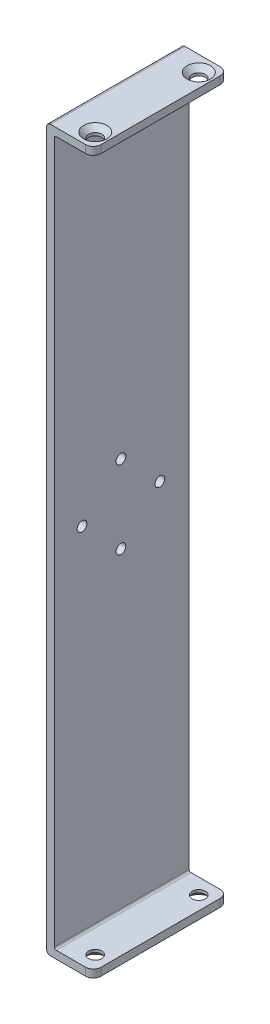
SolidWorks part; units mm, degrees
ref_plane "Front" through (0, 0, 0) normal (0, 0, 1) x (1, 0, 0)
ref_plane "Top" through (0, 0, 0) normal (0, 1, 0) x (1, 0, 0)
ref_plane "Right" through (0, 0, 0) normal (1, 0, 0) x (0, 0, -1)
sketch "Sketch1" plane through (0, 0, 0) normal (0, 0, 1) x (1, 0, 0)
  line L0 (12, 183) -> (12, 185)
  line L1 (0, 0) -> (12, 0)
  line L2 (0, 0) -> (0, 185)
  line L3 (0, 185) -> (12, 185)
  line L4 (12, 0) -> (12, 2)
  line L5 (12, 183) -> (2, 183)
  line L7 (12, 2) -> (2, 2)
  line L8 (2, 183) -> (2, 2)
  dimension "D1" = 2
  dimension "D2" = 2
  dimension "D3" = 2
  dimension "D4" = 181
  dimension "D5" = 10
extrude "Boss-Extrude1" add sketch "Sketch1" along normal blind 34.6
hole_wizard "CSK for M3 Cross recessed CTSK head wood screws1" positions "Sketch2" profile "Sketch4" countersink size "M3" standard "GB"
sketch "Sketch2" plane through (0, 185, 0) normal (0, 1, 0) x (1, 0, 0)
  line L1 (12, -34.6) -> (12, 0) construction
  line L11 (8.5, -4) -> (8.5, 0) construction
  line L12 (12, 0) -> (0, 0) construction
  line L14 (8.5, -30.6) -> (8.5, -34.6) construction
  line L15 (12, -34.6) -> (0, -34.6) construction
  point P0 (8.5, -4)
  point P2 (8.5, -30.6)
  dimension "D1" = 26.6
  dimension "D2" = 3.5
  dimension "D3" = 3.5
sketch "Sketch4" plane through (8.5, 185, 4) normal (1, 0, 0) x (0, 0, 1)
  line L0 (0, 0) -> (0, 5.5215)
  line L1 (0, 5.5215) -> (1.7, 4.5)
  line L2 (1.7, 4.5) -> (1.7, 1.3)
  line L3 (1.7, 1.3) -> (3, 0)
  line L5 (3, 0) -> (0, 0)
  line L6 (-1.7, 1.3) -> (-3, 0) construction
  line L10 (0, 5.5215) -> (-1.7, 4.5) construction
  line L11 (0, -6.35) -> (0, 107.95) construction
  dimension "Hole Dia." = 3.4
  dimension "Hole Depth" = 4.5
  dimension "Near C'Sink Dia." = 6
  dimension "Near C'Sink Angle" = 90
  dimension "Drill Angle" = 118
fillet "Fillet1" radius 1 2 edges at (0, 0, 17.3) (0, 185, 17.3)
fillet "Fillet2" radius 0.5 2 edges at (2, 183, 17.3) (2, 2, 17.3)
hole_wizard "CSK for M3 Cross recessed CTSK head wood screws2" positions "Sketch5" profile "Sketch6" countersink size "M3" standard "GB"
sketch "Sketch5" plane through (0, 0, 0) normal (0, -1, 0) x (-1, 0, 0)
  line L0 (-12, -34.6) -> (-12, 0) construction
  line L3 (-8.5, -4) -> (-8.5, 0) construction
  line L4 (-1, 0) -> (-12, 0) construction
  line L6 (-8.5, -30.6) -> (-8.5, -34.6) construction
  line L7 (-1, -34.6) -> (-12, -34.6) construction
  point P0 (-8.5, -30.6)
  point P2 (-8.5, -4)
  dimension "D1" = 3.5
  dimension "D2" = 26.6
  dimension "D4" = 3.5
sketch "Sketch6" plane through (8.5, 0, 30.6) normal (1, 0, 0) x (0, 0, -1)
  line L0 (0, 0) -> (0, 5.5215)
  line L1 (0, 5.5215) -> (1.7, 4.5)
  line L2 (1.7, 4.5) -> (1.7, 1.3)
  line L3 (1.7, 1.3) -> (3, 0)
  line L5 (3, 0) -> (0, 0)
  line L6 (-1.7, 1.3) -> (-3, 0) construction
  line L10 (0, 5.5215) -> (-1.7, 4.5) construction
  line L11 (0, -6.35) -> (0, 107.95) construction
  dimension "Hole Dia." = 3.4
  dimension "Hole Depth" = 4.5
  dimension "Near C'Sink Dia." = 6
  dimension "Near C'Sink Angle" = 90
  dimension "Drill Angle" = 118
hole_wizard "M3 Tapped Hole1" positions "Sketch9" profile "Sketch10" tap size "M3" standard "GB"
sketch "Sketch9" plane through (0, 0, 0) normal (-1, 0, 0) x (0, 0, 1)
  point P0 (17.5, 102.5)
  point P3 (7.5, 92.5)
  point P6 (17.5, 82.5)
  point P9 (27.5, 92.5)
sketch "Sketch10" plane through (0, 102.5, 17.5) normal (0, 1, 0) x (0, 0, 1)
  line L0 (0, 0) -> (0, 12)
  line L1 (0, 12) -> (1.25, 12)
  line L2 (1.25, 12) -> (1.25, 0)
  line L5 (1.25, 0) -> (0, 0)
  line L11 (0, -6.35) -> (0, 107.95) construction
  dimension "Thru Tap Drill Dia." = 2.5
  dimension "Thru Tap Drill Depth" = 12
fillet "Fillet3" radius 2 4 edges at (12, 1, 34.6) (12, 1, 0) (12, 184, 0) (12, 184, 34.6)
